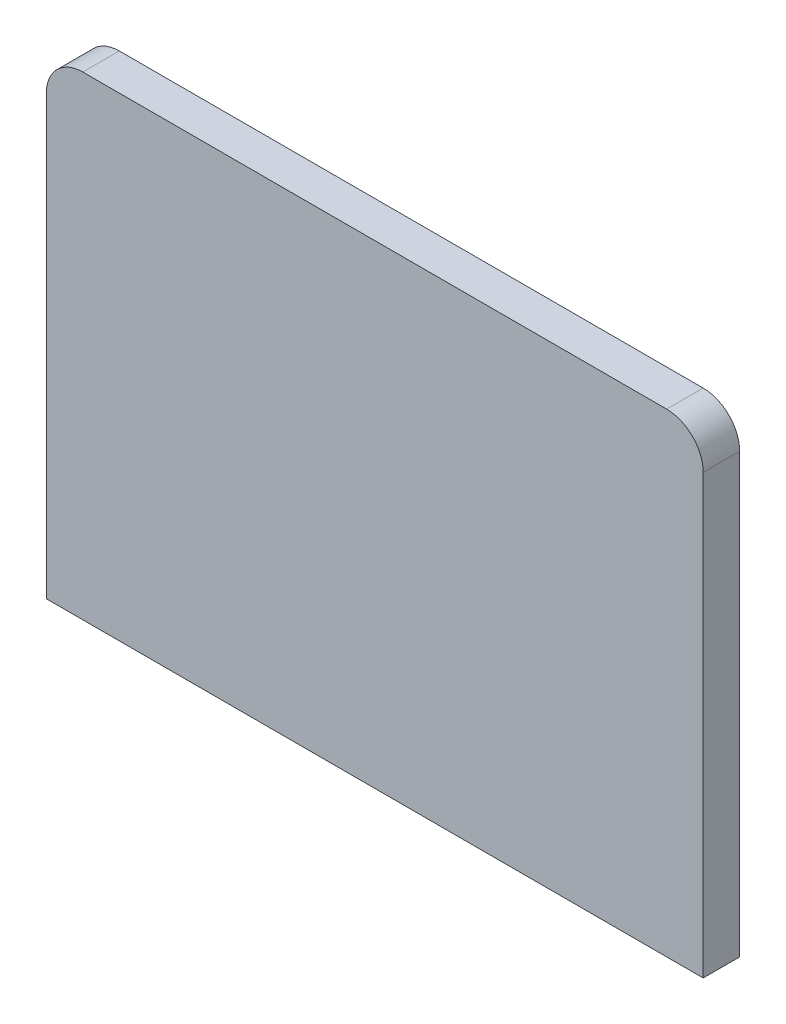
SolidWorks part; units mm, degrees
ref_plane "Front Plane" through (0, 0, 0) normal (0, 0, 1) x (1, 0, 0)
ref_plane "Top Plane" through (0, 0, 0) normal (0, 1, 0) x (1, 0, 0)
ref_plane "Right Plane" through (0, 0, 0) normal (1, 0, 0) x (0, 0, -1)
sketch "Sketch2" plane through (0, 0, 0) normal (0, 0, 1) x (1, 0, 0)
  line L0 (45, 40) -> (45, 100) construction
  line L1 (45, 40) -> (12.5, 40) construction
  line L2 (12.5, 40) -> (-12.5, 40) construction
  line L3 (-12.5, 40) -> (-45, 40) construction
  line L4 (-45, 40) -> (-45, 100) construction
  line L5 (40, 105) -> (-40, 105) construction
  line L12 (45, 40) -> (45, 100)
  line L13 (40, 105) -> (-40, 105)
  line L14 (-45, 100) -> (-45, 40)
  line L15 (-45, 40) -> (-12.5, 40)
  line L16 (-12.5, 40) -> (12.5, 40)
  line L17 (12.5, 40) -> (45, 40)
  arc A0 (45, 100) -> (40, 105) centre (40, 100) ccw construction
  arc A1 (-40, 105) -> (-45, 100) centre (-40, 100) ccw construction
  arc A4 (45, 100) -> (40, 105) centre (40, 100) ccw
  arc A5 (-40, 105) -> (-45, 100) centre (-40, 100) ccw
extrude "Boss-Extrude1" add sketch "Sketch2" along normal blind 5
